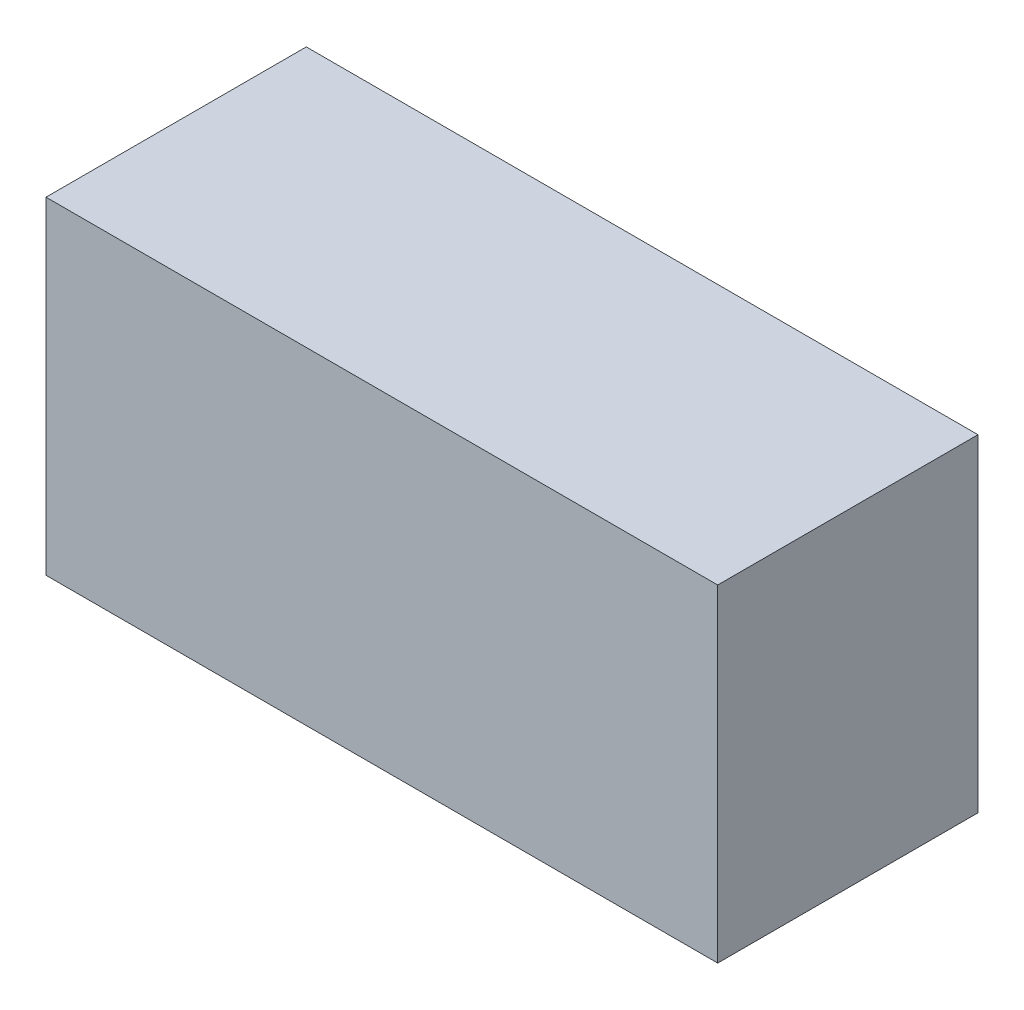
SolidWorks part; units mm, degrees
ref_plane "Alzado" through (0, 0, 0) normal (0, 0, 1) x (1, 0, 0)
ref_plane "Planta" through (0, 0, 0) normal (0, 1, 0) x (1, 0, 0)
ref_plane "Vista lateral" through (0, 0, 0) normal (1, 0, 0) x (0, 0, -1)
sketch "Croquis1" plane through (0, 0, 0) normal (1, 0, 0) x (0, 0, -1)
  line L1 (-7.75, 9.75) -> (7.75, 9.75)
  line L2 (-7.75, 9.75) -> (-7.75, -9.75)
  line L3 (-7.75, -9.75) -> (7.75, -9.75)
  line L4 (7.75, 9.75) -> (7.75, -9.75)
  line L5 (-7.75, 9.75) -> (7.75, -9.75) construction
  line L6 (-7.75, -9.75) -> (7.75, 9.75) construction
  point P0 (0, 0)
  dimension "D1" = 15.5
  dimension "D2" = 19.5
extrude "Saliente-Extruir1" add sketch "Croquis1" along normal blind 40 contours L2 L1 L4 L3
